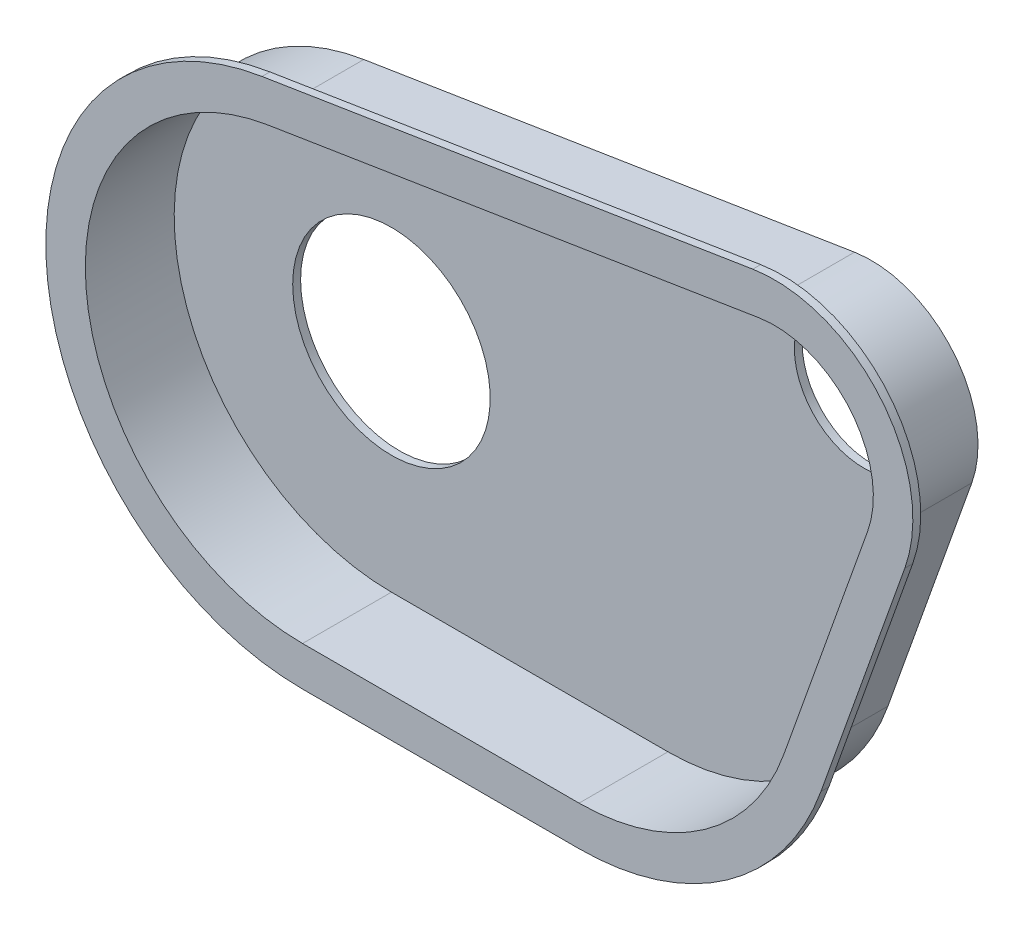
SolidWorks part; units mm, degrees
ref_plane "Front Plane" through (0, 0, 0) normal (0, 0, 1) x (1, 0, 0)
ref_plane "Top Plane" through (0, 0, 0) normal (0, 1, 0) x (1, 0, 0)
ref_plane "Right Plane" through (0, 0, 0) normal (1, 0, 0) x (0, 0, -1)
sketch "Sketch1" plane through (0, 0, 0) normal (0, 0, 1) x (1, 0, 0)
  line L0 (0, 0) -> (88.9, 0) construction
  line L1 (88.9, 0) -> (151.7618, 62.8618) construction
  line L2 (-11.0336, 68.973) -> (146.7465, 94.2132)
  line L3 (146.3453, 96.7213) -> (-11.4349, 71.4812)
  line L4 (184.0603, 51.3462) -> (157.0858, -24.3108)
  line L5 (181.6678, 52.1992) -> (154.6933, -23.4578)
  line L6 (0, -72.39) -> (88.9, -72.39)
  line L7 (88.9, -69.85) -> (0, -69.85)
  arc A0 (-11.0336, 68.973) -> (0, -69.85) centre (0, 0) ccw
  arc A1 (88.9, -69.85) -> (154.6933, -23.4578) centre (88.9, 0) ccw
  arc A2 (181.6678, 52.1992) -> (146.7465, 94.2132) centre (151.7618, 62.8618) ccw
  arc A3 (44.45, -57.1359) -> (155.3325, 28.7582) centre (88.9, 0) ccw construction
  arc A4 (-11.4349, 71.4812) -> (0, -72.39) centre (0, 0) ccw
  arc A5 (88.9, -72.39) -> (157.0858, -24.3108) centre (88.9, 0) ccw
  arc A6 (184.0603, 51.3462) -> (146.3453, 96.7213) centre (151.7618, 62.8618) ccw
  arc A7 (44.45, -53.8815) -> (151.4378, 31.1134) centre (88.9, 0) ccw construction
  arc A8 (151.4378, 31.1134) -> (120.0134, 62.5378) centre (151.7618, 62.8618) ccw construction
  arc A9 (155.3325, 28.7582) -> (117.6582, 66.4325) centre (151.7618, 62.8618) ccw construction
  arc A10 (117.6582, 66.4325) -> (44.45, 57.1359) centre (88.9, 0) ccw construction
  arc A11 (120.0134, 62.5378) -> (44.45, 53.8815) centre (88.9, 0) ccw construction
  arc A12 (44.45, 57.1359) -> (44.45, -57.1359) centre (0, 0) ccw construction
  arc A13 (44.45, 53.8815) -> (44.45, -53.8815) centre (0, 0) ccw construction
  dimension "D1" = 139.7
  dimension "D3" = 139.7
  dimension "D6" = 63.5
  dimension "D2" = 88.9
  dimension "D4" = 88.9
  dimension "D5" = 135
  dimension "D7" = 2.54
extrude "Boss-Extrude1" add sketch "Sketch1" along normal blind 28.575
sketch "Sketch5" plane through (0, 0, 0) normal (0, 0, -1) x (-1, 0, 0)
  line L0 (11.4349, 71.4812) -> (-146.3453, 96.7213)
  line L1 (0, -72.39) -> (-88.9, -72.39)
  line L2 (-184.0603, 51.3462) -> (-157.0858, -24.3108)
  arc A0 (0, -72.39) -> (11.4349, 71.4812) centre (0, 0) ccw
  arc A1 (-157.0858, -24.3108) -> (-88.9, -72.39) centre (-88.9, 0) ccw
  arc A2 (-146.3453, 96.7213) -> (-184.0603, 51.3462) centre (-151.7618, 62.8618) ccw
  circle A3 centre (-151.7618, 62.8618) radius 22.225
  circle A4 centre (0, 0) radius 31.75
  dimension "D1" = 63.5
  dimension "D2" = 44.45
extrude "Boss-Extrude2" add sketch "Sketch5" along normal blind 2.54
sketch "Sketch6" plane through (0, 0, 28.575) normal (0, 0, 1) x (1, 0, 0)
  line L0 (-11.4349, 71.4812) -> (146.3453, 96.7213)
  line L1 (0, -72.39) -> (88.9, -72.39)
  line L2 (157.0858, -24.3108) -> (184.0603, 51.3462)
  line L3 (-13.0398, 81.5136) -> (144.7404, 106.7537)
  line L4 (166.6557, -27.7228) -> (193.6302, 47.9341)
  line L5 (0, -82.55) -> (88.9, -82.55)
  arc A0 (-11.4349, 71.4812) -> (0, -72.39) centre (0, 0) ccw
  arc A1 (88.9, -72.39) -> (157.0858, -24.3108) centre (88.9, 0) ccw
  arc A2 (184.0603, 51.3462) -> (146.3453, 96.7213) centre (151.7618, 62.8618) ccw
  arc A3 (193.6302, 47.9341) -> (144.7404, 106.7537) centre (151.7618, 62.8618) ccw
  arc A4 (88.9, -82.55) -> (166.6557, -27.7228) centre (88.9, 0) ccw
  arc A5 (-13.0398, 81.5136) -> (0, -82.55) centre (0, 0) ccw
  dimension "D1" = 10.16
extrude "Boss-Extrude3" add sketch "Sketch6" against normal blind 2.54
